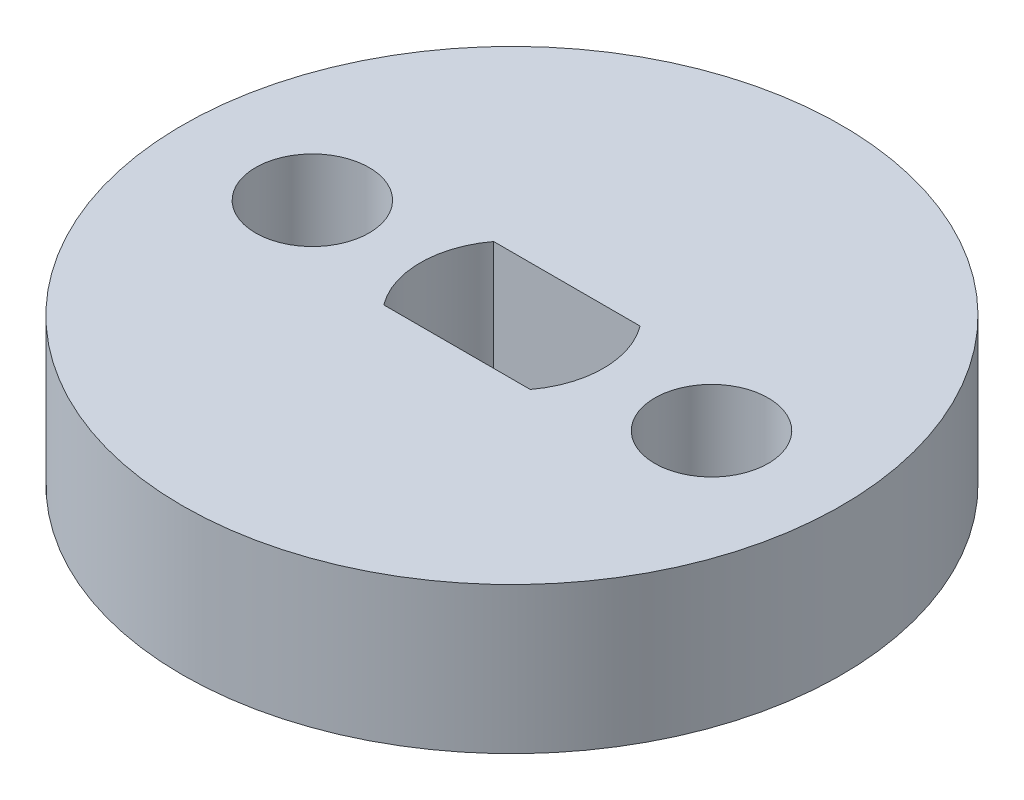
SolidWorks part; units mm, degrees
ref_plane "Front Plane" through (0, 0, 0) normal (0, 0, 1) x (1, 0, 0)
ref_plane "Top Plane" through (0, 0, 0) normal (0, 1, 0) x (1, 0, 0)
ref_plane "Right Plane" through (0, 0, 0) normal (1, 0, 0) x (0, 0, -1)
sketch "Sketch1" plane through (0, 0, 0) normal (0, 1, 0) x (1, 0, 0)
  circle A0 centre (0, 0) radius 9
  dimension "D1" = 18
base flange "Base-Flange1" sketch "Sketch1" thickness 4 reverse thickness direction no parameters "D1"=2
sketch "Sketch6" plane through (0, 0, 0) normal (0, 1, 0) x (1, 0, 0)
  line L1 (-2, 1.5) -> (2, 1.5)
  line L3 (0, -1.5) -> (2, -1.5)
  line L4 (0, -1.5) -> (-2, -1.5)
  arc A0 (-2, 1.5) -> (-2, -1.5) centre (0, 0) ccw
  arc A1 (2, -1.5) -> (2, 1.5) centre (0, 0) ccw
  point P7 (0, 1.5)
  dimension "D1" = 5
  dimension "D2" = 4
  dimension "D3" = 4
  dimension "D4" = 3
extrude "Cut-Extrude1" cut sketch "Sketch6" against normal blind 10
sketch "Sketch7" plane through (0, 0, 0) normal (0, 1, 0) x (1, 0, 0)
  line L0 (-5.45, 0) -> (5.45, 0) construction
  line L1 (-7, 0) -> (-9, 0) construction
  line L2 (7, 0) -> (9, 0) construction
  circle A0 centre (-5.45, 0) radius 1.55
  circle A1 centre (5.45, 0) radius 1.55
  circle A3 centre (0, 0) radius 9 construction
  point P4 (0, 0)
  dimension "D1" = 3.1
  dimension "D2" = 2
extrude "Cut-Extrude2" cut sketch "Sketch7" against normal blind 10
sketch "Bend-Lines1" plane through (0, 0, 0) normal (0, 1, 0) x (1, 0, 0)
sketch "Bounding-Box1" plane through (0, 0, 0) normal (0, 1, 0) x (1, 0, 0)
sheet metal parameters "Sheet-Metal1" thickness 4 parameters "D1"=2
flat pattern "Flat-Pattern1"
sketch "Bend-Lines2" plane through (0, 0, 0) normal (0, 1, 0) x (1, 0, 0)
sketch "Bounding-Box2" [suppressed] plane through (0, 0, 0) normal (0, 1, 0) x (1, 0, 0)
sheet metal parameters "Sheet-Metal2" thickness 4 parameters "D1"=2
flat pattern "Flat-Pattern1"
sketch "Bend-Lines2" plane through (0, 0, 0) normal (0, 1, 0) x (1, 0, 0)
sketch "Bounding-Box2" [suppressed] plane through (0, 0, 0) normal (0, 1, 0) x (1, 0, 0)
sheet metal parameters "Sheet-Metal3" thickness 4 parameters "D1"=2
flat pattern "Flat-Pattern1"
sketch "Bend-Lines2" plane through (0, 0, 0) normal (0, 1, 0) x (1, 0, 0)
sketch "Bounding-Box2" [suppressed] plane through (0, 0, 0) normal (0, 1, 0) x (1, 0, 0)
